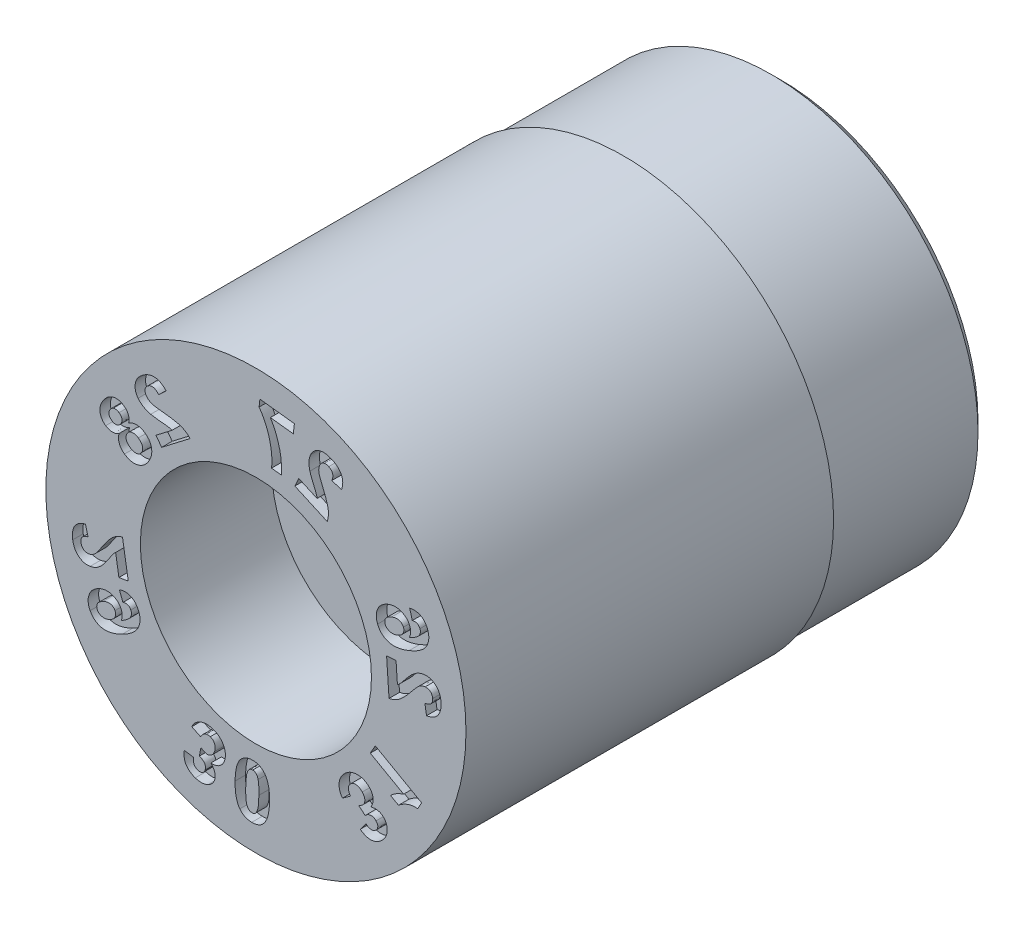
SolidWorks part; units mm, degrees
ref_plane "Front Plane" through (0, 0, 0) normal (0, 0, 1) x (1, 0, 0)
ref_plane "Top Plane" through (0, 0, 0) normal (0, 1, 0) x (1, 0, 0)
ref_plane "Right Plane" through (0, 0, 0) normal (1, 0, 0) x (0, 0, -1)
sketch "Sketch1" plane through (0, 0, 0) normal (1, 0, 0) x (0, 0, -1)
  line L2 (0, 4) -> (0, 2.2)
  line L3 (9.75, 4) -> (0, 4)
  line L4 (-3.7979, 0) -> (49996.2021, 0) construction
  line L8 (10, 1.15) -> (2.5, 1.15)
  line L9 (2.5, 2.2) -> (2.5, 1.15)
  line L10 (2.5, 2.2) -> (0, 2.2)
  line L12 (10, 1.15) -> (10, 3.75)
  line L16 (10, 3.75) -> (9.75, 4)
  dimension "D1" = 10
  dimension "D2" = 45
  dimension "D3" = 0.25
  dimension "D4" = 8
  dimension "D5" = 4.4
  dimension "D6" = 2.5
  dimension "D7" = 2.3
revolve "Revolve1" add sketch "Sketch1" angle 360 about L4
sketch "Sketch4" plane through (0, 0, 0) normal (1, 0, 0) x (0, 0, -1)
  line L0 (0, 0) -> (50000, 0) construction
  line L1 (10, -3.75) -> (10, 3.75) construction
  line L2 (7, 4.935) -> (10, 4.935)
  line L3 (7, 4.935) -> (7, 3.935)
  line L4 (7, 3.935) -> (10, 3.935)
  line L5 (10, 4.935) -> (10, 3.935)
  line L6 (9.75, 4) -> (0, 4) construction
  line L9 (0, 4.4) -> (0, -4.4) construction
  dimension "D1" = 1
  dimension "D2" = 0.065
  dimension "D3" = 7
revolve "Cut-Revolve1" cut sketch "Sketch4" angle 360 about L0
sketch "Sketch6" plane through (0, 0, 0) normal (0, 0, 1) x (1, 0, 0)
  arc A0 (2.5374, -0.2159) -> (2.4907, -0.5305) centre (0, 0) ccw construction
  text T0 "26   27   28   29   30   31" font "Arial" height 1.02
  dimension "D1" = 2.5465
extrude "Cut-Extrude1" cut sketch "Sketch6" against normal blind 0.2
